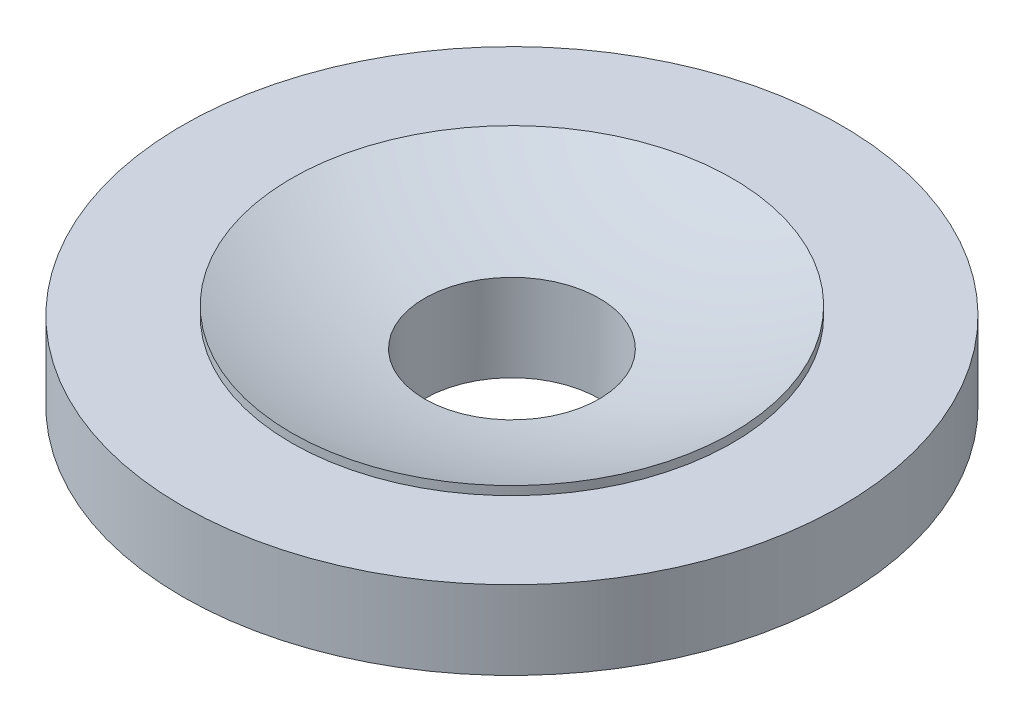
SolidWorks part; units mm, degrees
ref_plane "Front Plane" through (0, 0, 0) normal (0, 0, 1) x (1, 0, 0)
ref_plane "Top Plane" through (0, 0, 0) normal (0, 1, 0) x (1, 0, 0)
ref_plane "Right Plane" through (0, 0, 0) normal (1, 0, 0) x (0, 0, -1)
sketch "Sketch1" plane through (0, 0, 0) normal (0, 1, 0) x (1, 0, 0)
  line L0 (-0.9781, 0.2079) -> (0.9781, -0.2079)
  line L1 (-1, 0) -> (1, 0)
  line L2 (-1, 0) -> (-1, -99.995)
  line L3 (-1, -99.995) -> (1, -99.995)
  line L4 (1, 0) -> (1, -99.995)
  line L5 (-0.9781, 0.2079) -> (-21.7683, -97.602)
  line L6 (-21.7683, -97.602) -> (-19.812, -98.0178)
  line L7 (0.9781, -0.2079) -> (-19.812, -98.0178)
  line L8 (-0.9135, 0.4067) -> (0.9135, -0.4067)
  line L9 (-0.9135, 0.4067) -> (-41.5852, -90.9432)
  line L10 (-41.5852, -90.9432) -> (-39.7581, -91.7567)
  line L11 (0.9135, -0.4067) -> (-39.7581, -91.7567)
  line L12 (-0.809, 0.5878) -> (0.809, -0.5878)
  line L13 (-0.809, 0.5878) -> (-59.5846, -80.3099)
  line L14 (-59.5846, -80.3099) -> (-57.9666, -81.4854)
  line L15 (0.809, -0.5878) -> (-57.9666, -81.4854)
  line L16 (-0.6691, 0.7431) -> (0.6691, -0.7431)
  line L17 (-0.6691, 0.7431) -> (-74.9799, -66.1666)
  line L18 (-74.9799, -66.1666) -> (-73.6416, -67.6529)
  line L19 (0.6691, -0.7431) -> (-73.6416, -67.6529)
  line L20 (-0.5, 0.866) -> (0.5, -0.866)
  line L21 (-0.5, 0.866) -> (-87.0982, -49.1315)
  line L22 (-87.0982, -49.1315) -> (-86.0982, -50.8635)
  line L23 (0.5, -0.866) -> (-86.0982, -50.8635)
  line L24 (-0.309, 0.9511) -> (0.309, -0.9511)
  line L25 (-0.309, 0.9511) -> (-95.4099, -29.9491)
  line L26 (-95.4099, -29.9491) -> (-94.7919, -31.8512)
  line L27 (0.309, -0.9511) -> (-94.7919, -31.8512)
  line L28 (-0.1045, 0.9945) -> (0.1045, -0.9945)
  line L29 (-0.1045, 0.9945) -> (-99.5517, -9.4578)
  line L30 (-99.5517, -9.4578) -> (-99.3427, -11.4468)
  line L31 (0.1045, -0.9945) -> (-99.3427, -11.4468)
  line L32 (0.1045, 0.9945) -> (-0.1045, -0.9945)
  line L33 (0.1045, 0.9945) -> (-99.3427, 11.4468)
  line L34 (-99.3427, 11.4468) -> (-99.5517, 9.4578)
  line L35 (-0.1045, -0.9945) -> (-99.5517, 9.4578)
  line L36 (0.309, 0.9511) -> (-0.309, -0.9511)
  line L37 (0.309, 0.9511) -> (-94.7919, 31.8512)
  line L38 (-94.7919, 31.8512) -> (-95.4099, 29.9491)
  line L39 (-0.309, -0.9511) -> (-95.4099, 29.9491)
  line L40 (0.5, 0.866) -> (-0.5, -0.866)
  line L41 (0.5, 0.866) -> (-86.0982, 50.8635)
  line L42 (-86.0982, 50.8635) -> (-87.0982, 49.1315)
  line L43 (-0.5, -0.866) -> (-87.0982, 49.1315)
  line L44 (0.6691, 0.7431) -> (-0.6691, -0.7431)
  line L45 (0.6691, 0.7431) -> (-73.6416, 67.6529)
  line L46 (-73.6416, 67.6529) -> (-74.9799, 66.1666)
  line L47 (-0.6691, -0.7431) -> (-74.9799, 66.1666)
  line L48 (0.809, 0.5878) -> (-0.809, -0.5878)
  line L49 (0.809, 0.5878) -> (-57.9666, 81.4854)
  line L50 (-57.9666, 81.4854) -> (-59.5846, 80.3099)
  line L51 (-0.809, -0.5878) -> (-59.5846, 80.3099)
  line L52 (0.9135, 0.4067) -> (-0.9135, -0.4067)
  line L53 (0.9135, 0.4067) -> (-39.7581, 91.7567)
  line L54 (-39.7581, 91.7567) -> (-41.5852, 90.9432)
  line L55 (-0.9135, -0.4067) -> (-41.5852, 90.9432)
  line L56 (0.9781, 0.2079) -> (-0.9781, -0.2079)
  line L57 (0.9781, 0.2079) -> (-19.812, 98.0178)
  line L58 (-19.812, 98.0178) -> (-21.7683, 97.602)
  line L59 (-0.9781, -0.2079) -> (-21.7683, 97.602)
  line L60 (1, 0) -> (-1, 0)
  line L61 (1, 0) -> (1, 99.995)
  line L62 (1, 99.995) -> (-1, 99.995)
  line L63 (-1, 0) -> (-1, 99.995)
  line L64 (0.9781, -0.2079) -> (-0.9781, 0.2079)
  line L65 (0.9781, -0.2079) -> (21.7683, 97.602)
  line L66 (21.7683, 97.602) -> (19.812, 98.0178)
  line L67 (-0.9781, 0.2079) -> (19.812, 98.0178)
  line L68 (0.9135, -0.4067) -> (-0.9135, 0.4067)
  line L69 (0.9135, -0.4067) -> (41.5852, 90.9432)
  line L70 (41.5852, 90.9432) -> (39.7581, 91.7567)
  line L71 (-0.9135, 0.4067) -> (39.7581, 91.7567)
  line L72 (0.809, -0.5878) -> (-0.809, 0.5878)
  line L73 (0.809, -0.5878) -> (59.5846, 80.3099)
  line L74 (59.5846, 80.3099) -> (57.9666, 81.4854)
  line L75 (-0.809, 0.5878) -> (57.9666, 81.4854)
  line L76 (0.6691, -0.7431) -> (-0.6691, 0.7431)
  line L77 (0.6691, -0.7431) -> (74.9799, 66.1666)
  line L78 (74.9799, 66.1666) -> (73.6416, 67.6529)
  line L79 (-0.6691, 0.7431) -> (73.6416, 67.6529)
  line L80 (0.5, -0.866) -> (-0.5, 0.866)
  line L81 (0.5, -0.866) -> (87.0982, 49.1315)
  line L82 (87.0982, 49.1315) -> (86.0982, 50.8635)
  line L83 (-0.5, 0.866) -> (86.0982, 50.8635)
  line L84 (0.309, -0.9511) -> (-0.309, 0.9511)
  line L85 (0.309, -0.9511) -> (95.4099, 29.9491)
  line L86 (95.4099, 29.9491) -> (94.7919, 31.8512)
  line L87 (-0.309, 0.9511) -> (94.7919, 31.8512)
  line L88 (0.1045, -0.9945) -> (-0.1045, 0.9945)
  line L89 (0.1045, -0.9945) -> (99.5517, 9.4578)
  line L90 (99.5517, 9.4578) -> (99.3427, 11.4468)
  line L91 (-0.1045, 0.9945) -> (99.3427, 11.4468)
  line L92 (-0.1045, -0.9945) -> (0.1045, 0.9945)
  line L93 (-0.1045, -0.9945) -> (99.3427, -11.4468)
  line L94 (99.3427, -11.4468) -> (99.5517, -9.4578)
  line L95 (0.1045, 0.9945) -> (99.5517, -9.4578)
  line L96 (-0.309, -0.9511) -> (0.309, 0.9511)
  line L97 (-0.309, -0.9511) -> (94.7919, -31.8512)
  line L98 (94.7919, -31.8512) -> (95.4099, -29.9491)
  line L99 (0.309, 0.9511) -> (95.4099, -29.9491)
  line L100 (-0.5, -0.866) -> (0.5, 0.866)
  line L101 (-0.5, -0.866) -> (86.0982, -50.8635)
  line L102 (86.0982, -50.8635) -> (87.0982, -49.1315)
  line L103 (0.5, 0.866) -> (87.0982, -49.1315)
  line L104 (-0.6691, -0.7431) -> (0.6691, 0.7431)
  line L105 (-0.6691, -0.7431) -> (73.6416, -67.6529)
  line L106 (73.6416, -67.6529) -> (74.9799, -66.1666)
  line L107 (0.6691, 0.7431) -> (74.9799, -66.1666)
  line L108 (-0.809, -0.5878) -> (0.809, 0.5878)
  line L109 (-0.809, -0.5878) -> (57.9666, -81.4854)
  line L110 (57.9666, -81.4854) -> (59.5846, -80.3099)
  line L111 (0.809, 0.5878) -> (59.5846, -80.3099)
  line L112 (-0.9135, -0.4067) -> (0.9135, 0.4067)
  line L113 (-0.9135, -0.4067) -> (39.7581, -91.7567)
  line L114 (39.7581, -91.7567) -> (41.5852, -90.9432)
  line L115 (0.9135, 0.4067) -> (41.5852, -90.9432)
  line L116 (-0.9781, -0.2079) -> (0.9781, 0.2079)
  line L117 (-0.9781, -0.2079) -> (19.812, -98.0178)
  line L118 (19.812, -98.0178) -> (21.7683, -97.602)
  line L119 (0.9781, 0.2079) -> (21.7683, -97.602)
  circle A1 centre (0, 0) radius 100
  point P7 (0, 0)
  point P126 (0, 0)
  dimension "D1" = 200
  dimension "D2" = 2
  dimension "D3" = 30
sketch "Sketch7" plane through (0, 0, 0) normal (0, 0, 1) x (1, 0, 0)
  line L0 (0, 0) -> (0, -20) construction
  line L2 (100, 0) -> (-100, 0) construction
  line L4 (-101, 0) -> (-101, -4)
  line L5 (0, -20) -> (0, -60)
  line L6 (-101, -4) -> (-151, -4)
  line L8 (-100.0283, -39.9882) -> (-151, -39.9882)
  line L9 (-151, -4) -> (-151, -39.9882)
  arc A0 (-101, 0) -> (0, -20) centre (-0.9954, 239.9981) ccw
  arc A1 (0, -60) -> (-100.0283, -39.9882) centre (0, 200) cw
  point P13 (-100, -40)
  dimension "D3" = 40
  dimension "D4" = 260
  dimension "D5" = 260
  dimension "D1" = 20
  dimension "D2" = 40
  dimension "D6" = 101
  dimension "D7" = 4
  dimension "D8" = 50
revolve "Revolve4" add sketch "Sketch7" angle 360 about L0
sketch "Sketch9" plane through (0, 0, 0) normal (0, 1, 0) x (1, 0, 0)
  circle A0 centre (0, 0) radius 40
  dimension "D1" = 80
extrude "Cut-Extrude3" cut sketch "Sketch9" against normal through all and the other way through all
extrude "Cut-Extrude4" [suppressed] cut sketch "Sketch1" against normal through all contours L19 A1 L13
